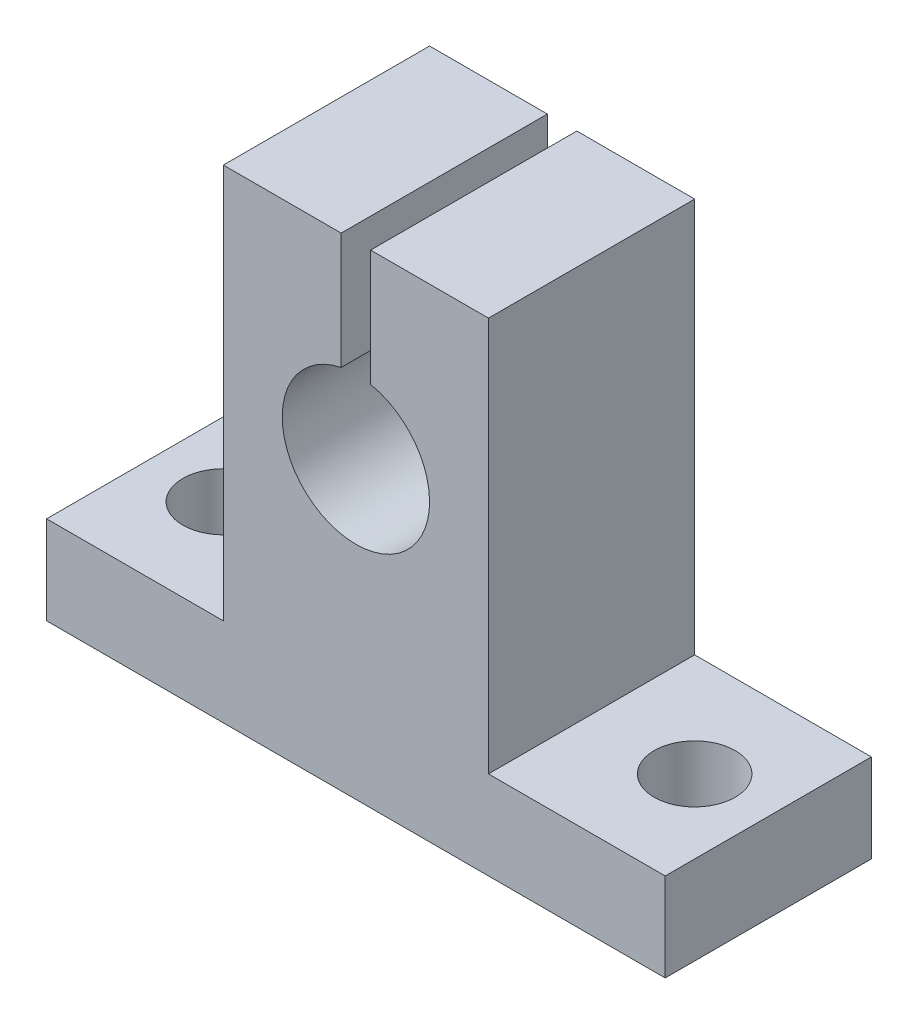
SolidWorks part; units mm, degrees
ref_plane "Ebene vorne" through (0, 0, 0) normal (0, 0, 1) x (1, 0, 0)
ref_plane "Ebene oben" through (0, 0, 0) normal (0, 1, 0) x (1, 0, 0)
ref_plane "Ebene rechts" through (0, 0, 0) normal (1, 0, 0) x (0, 0, -1)
ref_plane "Ebene1" through (0, 0, 7) normal (0, 0, 1) x (1, 0, 0)
sketch "Skizze1" plane through (0, 0, 7) normal (0, 0, 1) x (1, 0, 0)
  line L0 (21, 12.8) -> (-21, 12.8)
  line L1 (-21, 12.8) -> (-21, -20)
  line L2 (-21, -20) -> (21, -20)
  line L3 (21, -20) -> (21, 12.8)
extrude "Aufsatz-Linear austragen1" add sketch "Skizze1" against normal blind 14
sketch "Skizze2" plane through (0, 0, -7) normal (0, 0, -1) x (-1, 0, 0)
  line L0 (21, 12.8) -> (9, 12.8)
  line L1 (9, 12.8) -> (9, -14)
  line L2 (9, -14) -> (21, -14)
  line L3 (21, -14) -> (21, 12.8)
extrude "Schnitt-Linear austragen1" cut sketch "Skizze2" against normal through all
sketch "Skizze3" plane through (0, 0, -7) normal (0, 0, -1) x (-1, 0, 0)
  line L0 (-21, -14) -> (-9, -14)
  line L1 (-9, -14) -> (-9, 12.8)
  line L2 (-9, 12.8) -> (-21, 12.8)
  line L3 (-21, 12.8) -> (-21, -14)
extrude "Schnitt-Linear austragen2" cut sketch "Skizze3" against normal through all
sketch "Skizze4" plane through (0, 0, -7) normal (0, 0, -1) x (-1, 0, 0)
  line L0 (1, 12.8) -> (-1, 12.8)
  line L1 (-1, 12.8) -> (-1, 4.899)
  line L2 (1, 4.899) -> (1, 12.8)
  arc A0 (-1, 4.899) -> (1, 4.899) centre (0, 0) cw
extrude "Schnitt-Linear austragen3" cut sketch "Skizze4" against normal through all
sketch "Skizze5" plane through (0, 0, 0) normal (0, 1, 0) x (1, 0, 0)
  line L0 (5, 7) -> (0, 7)
  line L1 (0, 7) -> (0, -7)
  line L2 (0, -7) -> (5, -7)
  line L3 (5, -7) -> (5, 7)
  line L4 (0, 7) -> (0, -7) construction
revolve "Schnitt-Rotation1" cut sketch "Skizze5" angle 360 about L4
hole_wizard "Ø5.5 (5.5) Durchmesser Bohrung1" positions "Skizze7" profile "Skizze6" hole size "Ø5.5" standard "ANSI Metrisch"
sketch "Skizze7" plane through (0, -20, 0) normal (0, -1, 0) x (-1, 0, 0)
  point P0 (-16, 0)
sketch "Skizze6" plane through (16, -20, 0) normal (1, 0, 0) x (0, 0, -1)
  line L0 (0, 0) -> (0, 32.8)
  line L1 (0, 32.8) -> (2.75, 32.8)
  line L2 (2.75, 32.8) -> (2.75, 0)
  line L5 (2.75, 0) -> (0, 0)
  line L11 (0, -6.35) -> (0, 107.95) construction
  dimension "Bohrerdurchmesser" = 5.5
  dimension "Bohrungstiefe" = 32.8
hole_wizard "Ø5.5 (5.5) Durchmesser Bohrung2" positions "Skizze9" profile "Skizze8" hole size "Ø5.5" standard "ANSI Metrisch"
sketch "Skizze9" plane through (0, -14, 0) normal (0, 1, 0) x (1, 0, 0)
  point P0 (-16, 0)
sketch "Skizze8" plane through (-16, -14, 0) normal (1, 0, 0) x (0, 0, 1)
  line L0 (0, 0) -> (0, 6)
  line L1 (0, 6) -> (2.75, 6)
  line L2 (2.75, 6) -> (2.75, 0)
  line L5 (2.75, 0) -> (0, 0)
  line L11 (0, -6.35) -> (0, 107.95) construction
  dimension "Bohrerdurchmesser" = 5.5
  dimension "Bohrungstiefe" = 6
